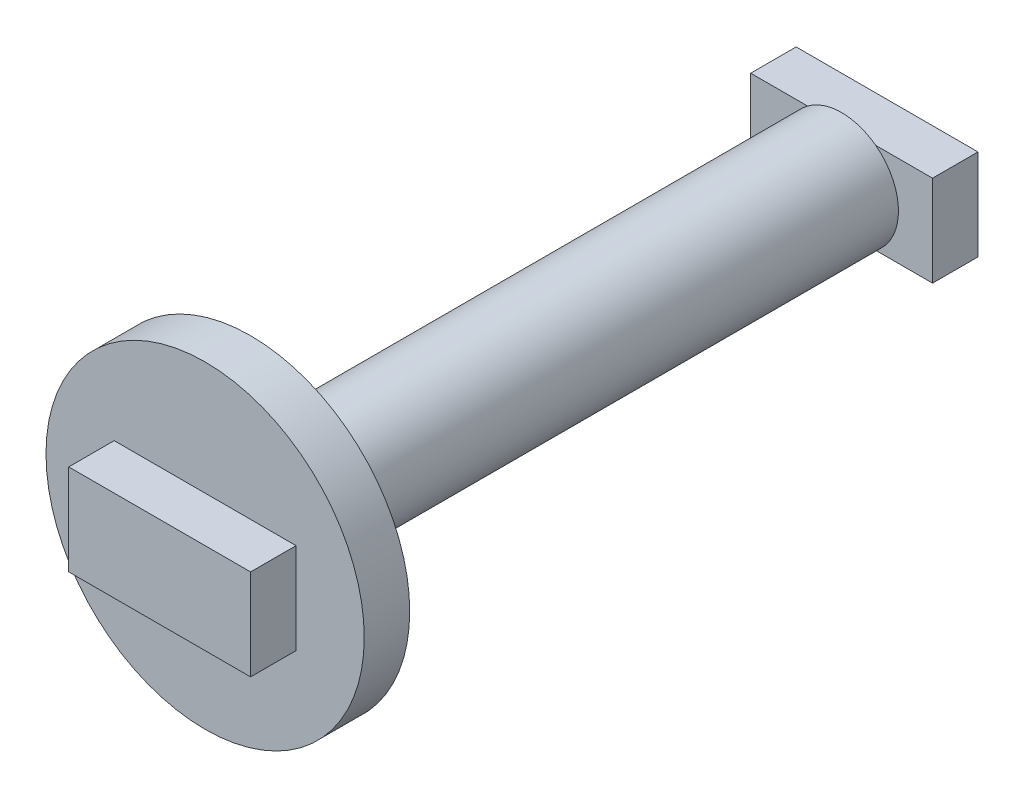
SolidWorks part; units mm, degrees
ref_plane "Front Plane" through (0, 0, 0) normal (0, 0, 1) x (1, 0, 0)
ref_plane "Top Plane" through (0, 0, 0) normal (0, 1, 0) x (1, 0, 0)
ref_plane "Right Plane" through (0, 0, 0) normal (1, 0, 0) x (0, 0, -1)
sketch "Sketch1" plane through (0, 0, 0) normal (0, 0, 1) x (1, 0, 0)
  circle A0 centre (0, 0) radius 12.5
  dimension "D1" = 25
extrude "Boss-Extrude1" add sketch "Sketch1" along normal blind 130
sketch "Sketch2" plane through (0, 0, 130) normal (0, 0, 1) x (1, 0, 0)
  circle A0 centre (0, 0) radius 35
  dimension "D1" = 70
extrude "Boss-Extrude2" add sketch "Sketch2" along normal blind 10
sketch "Sketch3" plane through (0, 0, 140) normal (0, 0, 1) x (1, 0, 0)
  line L1 (20, 10) -> (-20, 10)
  line L2 (20, 10) -> (20, -10)
  line L3 (20, -10) -> (-20, -10)
  line L4 (-20, 10) -> (-20, -10)
  line L5 (20, 10) -> (-20, -10) construction
  line L6 (20, -10) -> (-20, 10) construction
  point P0 (0, 0)
  dimension "D1" = 20
  dimension "D2" = 40
extrude "Boss-Extrude3" add sketch "Sketch3" along normal blind 10
sketch "Sketch4" plane through (0, 0, 0) normal (0, 0, -1) x (-1, 0, 0)
  line L1 (20, 10) -> (-20, 10)
  line L2 (20, 10) -> (20, -10)
  line L3 (20, -10) -> (-20, -10)
  line L4 (-20, 10) -> (-20, -10)
  line L5 (20, 10) -> (-20, -10) construction
  line L6 (20, -10) -> (-20, 10) construction
  point P0 (0, 0)
  dimension "D1" = 20
  dimension "D2" = 40
extrude "Boss-Extrude4" add sketch "Sketch4" along normal blind 10
